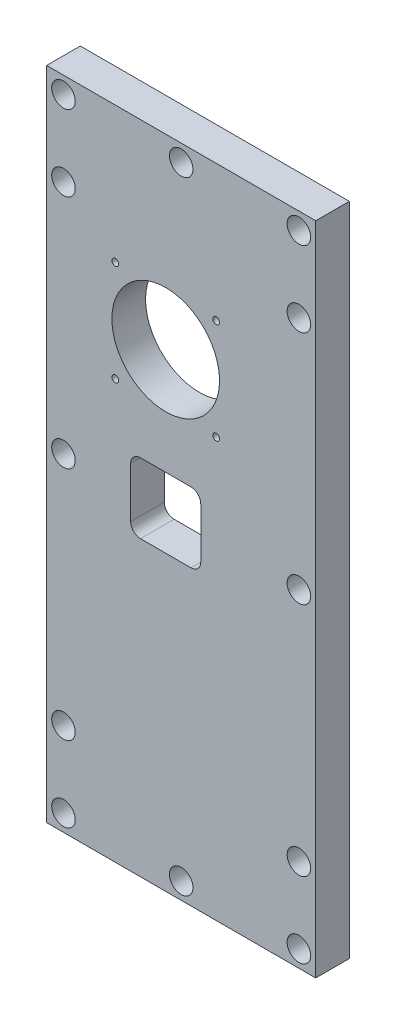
SolidWorks part; units mm, degrees
ref_plane "Ebene vorne" through (0, 0, 0) normal (0, 0, 1) x (1, 0, 0)
ref_plane "Ebene oben" through (0, 0, 0) normal (0, 1, 0) x (1, 0, 0)
ref_plane "Ebene rechts" through (0, 0, 0) normal (1, 0, 0) x (0, 0, -1)
sketch "Skizze1" plane through (0, 0, 0) normal (0, 0, 1) x (1, 0, 0)
  line L1 (-69.0594, 70.0995) -> (10.9406, 70.0995)
  line L2 (-69.0594, 70.0995) -> (-69.0594, -124.9005)
  line L3 (-69.0594, -124.9005) -> (10.9406, -124.9005)
  line L4 (10.9406, 70.0995) -> (10.9406, -124.9005)
  dimension "D1" = 195
  dimension "D2" = 80
extrude "Aufsatz-Linear austragen1" add sketch "Skizze1" against normal blind 10
sketch "Skizze2" plane through (0, 0, -10) normal (0, 0, -1) x (-1, 0, 0)
  line L0 (69.0594, 70.0995) -> (69.0594, -124.9005) construction
  line L1 (33.6594, 14.5995) -> (33.6594, -27.4005) construction
  line L3 (33.6594, 14.5995) -> (69.0594, 14.5995) construction
  line L5 (18.6594, 29.5995) -> (48.6594, 29.5995) construction
  line L6 (48.6594, 29.5995) -> (48.6594, -0.4005) construction
  line L7 (48.6594, -0.4005) -> (18.6594, -0.4005) construction
  line L8 (18.6594, -0.4005) -> (18.6594, 29.5995) construction
  line L9 (18.6594, 29.5995) -> (48.6594, -0.4005) construction
  line L10 (69.0594, -27.4005) -> (-10.9406, -27.4005) construction
  line L11 (-10.9406, -124.9005) -> (-10.9406, 70.0995) construction
  line L12 (23.2413, -19.9005) -> (23.2413, -34.9005)
  line L13 (26.1594, -16.9824) -> (41.1594, -16.9824)
  line L14 (44.0774, -19.9005) -> (44.0774, -34.9005)
  line L15 (41.1594, -37.8185) -> (26.1594, -37.8185)
  line L16 (23.2413, -19.9005) -> (44.0774, -34.9005) construction
  line L17 (26.1594, -37.8185) -> (41.1594, -16.9824) construction
  circle A0 centre (18.6594, 29.5995) radius 1
  circle A1 centre (48.6594, 29.5995) radius 1
  circle A2 centre (18.6594, -0.4005) radius 1
  circle A3 centre (48.6594, -0.4005) radius 1
  circle A4 centre (33.6594, 14.5995) radius 16
  arc A5 (23.2413, -19.9005) -> (26.1594, -16.9824) centre (26.1594, -19.9005) cw
  arc A6 (41.1594, -16.9824) -> (44.0774, -19.9005) centre (41.1594, -19.9005) cw
  arc A7 (44.0774, -34.9005) -> (41.1594, -37.8185) centre (41.1594, -34.9005) cw
  arc A8 (26.1594, -37.8185) -> (23.2413, -34.9005) centre (26.1594, -34.9005) cw
  point P22 (33.6594, 14.5995)
  point P32 (33.6594, -27.4005)
  dimension "D1" = 30
  dimension "D3" = 2
  dimension "D2" = 30
  dimension "D4" = 35.4
  dimension "D5" = 42
  dimension "D6" = 15
extrude "Schnitt-Linear austragen1" cut sketch "Skizze2" against normal blind 10
sketch "Skizze3" plane through (0, 0, -10) normal (0, 0, -1) x (-1, 0, 0)
  line L0 (-5.9406, 65.0995) -> (64.0594, 65.0995) construction
  line L1 (64.0594, 65.0995) -> (64.0594, 42.5995) construction
  line L2 (64.0594, 42.5995) -> (64.0594, -27.4005) construction
  line L3 (69.0594, 70.0995) -> (69.0594, -124.9005) construction
  line L4 (64.0594, -27.4005) -> (64.0594, -97.4005) construction
  line L5 (64.0594, -97.4005) -> (64.0594, -119.9005) construction
  line L6 (64.0594, -119.9005) -> (-5.9406, -119.9005) construction
  line L7 (-5.9406, -119.9005) -> (-5.9406, -97.4005) construction
  line L8 (-5.9406, -97.4005) -> (-5.9406, -27.4005) construction
  line L10 (-5.9406, -27.4005) -> (-5.9406, 42.5995) construction
  line L11 (-5.9406, 42.5995) -> (-5.9406, 65.0995) construction
  line L12 (29.0594, 65.0995) -> (29.0594, 70.0995) construction
  line L13 (-10.9406, 70.0995) -> (69.0594, 70.0995) construction
  line L14 (29.0594, -119.9005) -> (29.0594, -124.9005) construction
  line L15 (69.0594, -124.9005) -> (-10.9406, -124.9005) construction
  line L16 (-10.9406, -124.9005) -> (-10.9406, 70.0995) construction
  circle A0 centre (-5.9406, 65.0995) radius 1.7
  circle A1 centre (64.0594, 65.0995) radius 1.7
  circle A2 centre (29.0594, 65.0995) radius 1.7
  circle A3 centre (64.0594, 42.5995) radius 1.7
  circle A5 centre (64.0594, -27.4005) radius 1.7
  circle A6 centre (64.0594, -97.4005) radius 1.7
  circle A7 centre (64.0594, -119.9005) radius 1.7
  circle A8 centre (29.0594, -119.9005) radius 1.7
  circle A9 centre (-5.9406, -119.9005) radius 1.7
  circle A10 centre (-5.9406, -97.4005) radius 1.7
  circle A11 centre (-5.9406, -27.4005) radius 1.7
  circle A13 centre (-5.9406, 42.5995) radius 1.7
  dimension "D4" = 3.4
  dimension "D1" = 5
  dimension "D2" = 5
  dimension "D3" = 5
  dimension "D5" = 70
  dimension "D6" = 5
extrude "Schnitt-Linear austragen2" cut sketch "Skizze3" against normal blind 5
sketch "Skizze4" plane through (0, 0, 0) normal (0, 0, 1) x (1, 0, 0)
  line L0 (-64.0594, 65.0995) -> (-64.0594, 42.5995) construction
  line L1 (-64.0594, 42.5995) -> (-64.0594, -27.4005) construction
  line L2 (-64.0594, -27.4005) -> (-64.0594, -97.4005) construction
  line L3 (-64.0594, -97.4005) -> (-64.0594, -119.9005) construction
  line L4 (5.9406, 65.0995) -> (5.9406, 42.5995) construction
  line L5 (5.9406, -119.9005) -> (-64.0594, -119.9005) construction
  line L6 (5.9406, 42.5995) -> (5.9406, -27.4005) construction
  line L7 (5.9406, -27.4005) -> (5.9406, -97.4005) construction
  line L8 (5.9406, -97.4005) -> (5.9406, -119.9005) construction
  line L9 (-69.0594, 70.0995) -> (-69.0594, -124.9005) construction
  line L11 (-64.0594, 65.0995) -> (5.9406, 65.0995) construction
  line L12 (-29.0594, 65.0995) -> (-29.0594, 70.0995) construction
  line L13 (10.9406, 70.0995) -> (-69.0594, 70.0995) construction
  line L15 (-69.0594, -124.9005) -> (10.9406, -124.9005) construction
  circle A0 centre (-64.0594, 65.0995) radius 3.5
  circle A1 centre (5.9406, 65.0995) radius 3.5
  circle A2 centre (5.9406, 42.5995) radius 3.5
  circle A3 centre (5.9406, -27.4005) radius 3.5
  circle A5 centre (5.9406, -97.4005) radius 3.5
  circle A6 centre (5.9406, -119.9005) radius 3.5
  circle A7 centre (-64.0594, -119.9005) radius 3.5
  circle A8 centre (-64.0594, -97.4005) radius 3.5
  circle A10 centre (-64.0594, -27.4005) radius 3.5
  circle A11 centre (-64.0594, 42.5995) radius 3.5
  circle A12 centre (-29.0594, -119.9005) radius 3.5
  circle A13 centre (-29.0594, 65.0995) radius 3.5
  dimension "D4" = 7
  dimension "D1" = 70
  dimension "D2" = 5
  dimension "D3" = 5
  dimension "D5" = 5
extrude "Schnitt-Linear austragen3" cut sketch "Skizze4" against normal blind 5
sketch "Skizze5" plane through (-69.0594, 0, 0) normal (-1, 0, 0) x (0, 0, 1)
  line L0 (0, 14.5995) -> (-10, 14.5995) construction
  line L1 (-5, 14.5995) -> (-5, -0.4005) construction
  line L2 (-5, 14.5995) -> (-5, 29.5995) construction
  line L3 (-10, 70.0995) -> (-10, -124.9005) construction
  line L4 (0, 70.0995) -> (0, -124.9005) construction
  line L5 (-10, 70.0995) -> (0, 70.0995) construction
  circle A0 centre (-5, 29.5995) radius 1
  circle A1 centre (-5, -0.4005) radius 1
  dimension "D1" = 2
  dimension "D2" = 30
  dimension "D3" = 55.5
sketch "Skizze6" plane through (10.9406, 0, 0) normal (1, 0, 0) x (0, 0, -1)
  line L0 (10, 14.5995) -> (0, 14.5995) construction
  line L1 (5, 14.5995) -> (5, -0.4005) construction
  line L2 (5, 14.5995) -> (5, 29.5995) construction
  line L3 (0, -124.9005) -> (0, 70.0995) construction
  line L4 (10, -124.9005) -> (10, 70.0995) construction
  line L5 (10, 70.0995) -> (0, 70.0995) construction
  circle A0 centre (5, 29.5995) radius 1
  circle A1 centre (5, -0.4005) radius 1
  dimension "D1" = 2
  dimension "D2" = 30
  dimension "D3" = 55.5
